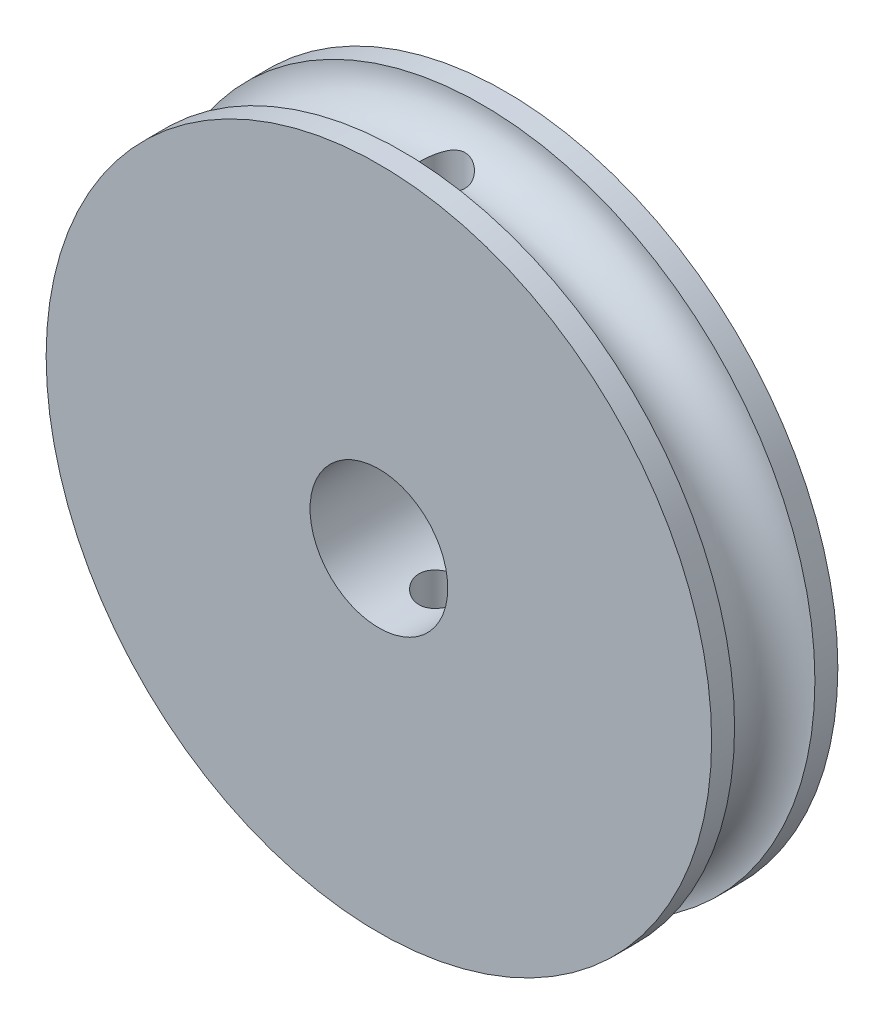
SolidWorks part; units mm, degrees
ref_plane "Plan de face" through (0, 0, 0) normal (0, 0, 1) x (1, 0, 0)
ref_plane "Plan de dessus" through (0, 0, 0) normal (0, 1, 0) x (1, 0, 0)
ref_plane "Plan de droite" through (0, 0, 0) normal (1, 0, 0) x (0, 0, -1)
sketch "Esquisse2" plane through (0, 0, 0) normal (0, 0, 1) x (1, 0, 0)
  circle A0 centre (0, 0) radius 14.5
  circle A1 centre (0, 0) radius 3
  dimension "D1" = 29
  dimension "D2" = 6
extrude "Boss.-Extru.1" add sketch "Esquisse2" along normal blind 5.5
sketch "Esquisse3" plane through (0, 0, 0) normal (1, 0, 0) x (0, 0, -1)
  line L0 (0, 0) -> (-9.65, 0) construction
  line L1 (0, 14.5) -> (-5.5, 14.5) construction
  circle A0 centre (-2.75, 14.5) radius 1.75
  dimension "D1" = 3.5
revolve "Enlèvement de matière-Révolution1" cut sketch "Esquisse3" angle 360 about L0
sketch "Esquisse4" plane through (0, 0, 0) normal (0, 1, 0) x (1, 0, 0)
  line L0 (0, 0) -> (0, -5.5) construction
  line L1 (-14.5, -5.5) -> (14.5, -5.5) construction
  circle A0 centre (0, -2.75) radius 1
  dimension "D1" = 2
extrude "Enlèv. mat.-Extru.1" cut sketch "Esquisse4" against normal through all both and the other way through all
sketch "Esquisse5" plane through (0, 0, 0) normal (0, 0, -1) x (-1, 0, 0)
  line L0 (0, 0) -> (0, 14.1316) construction
  line L1 (0, 0) -> (10.1405, 0) construction
  circle A0 centre (0, 8) radius 1
  circle A1 centre (0, 0) radius 3 construction
  circle A2 centre (0, -8) radius 1
  dimension "D1" = 2
  dimension "D2" = 8
extrude "Enlèv. mat.-Extru.2" cut sketch "Esquisse5" against normal blind 2
ref_plane "Plan1" through (0, 0, 2.75) normal (0, 0, 1) x (1, 0, 0)
